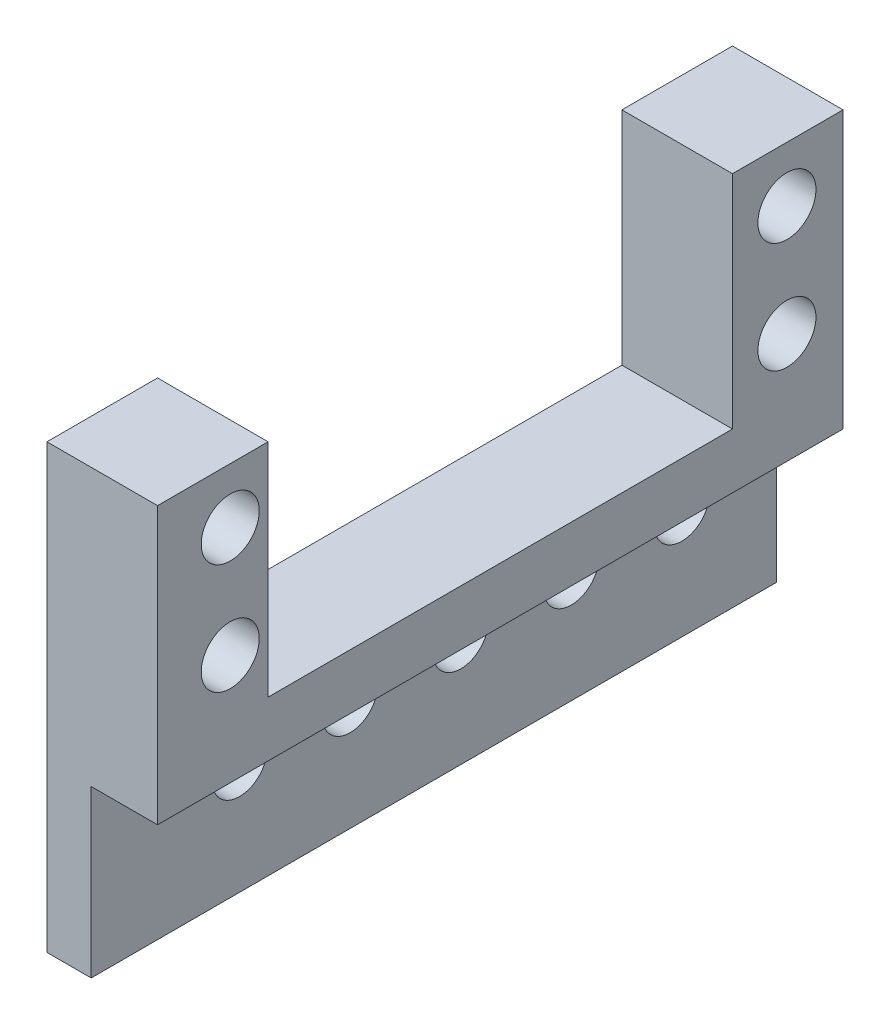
SolidWorks part; units mm, degrees
ref_plane "Front Plane" through (0, 0, 0) normal (0, 0, 1) x (1, 0, 0)
ref_plane "Top Plane" through (0, 0, 0) normal (0, 1, 0) x (1, 0, 0)
ref_plane "Right Plane" through (0, 0, 0) normal (1, 0, 0) x (0, 0, -1)
sketch "Sketch2" plane through (0, 0, 0) normal (0, 1, 0) x (1, 0, 0)
  line L1 (0, 0) -> (10, 0)
  line L2 (0, 0) -> (0, -62)
  line L3 (0, -62) -> (10, -62)
  line L4 (10, 0) -> (10, -62)
  line L5 (0, 0) -> (10, -62) construction
  line L6 (0, -62) -> (10, 0) construction
  point P4 (5, -31)
  dimension "D1" = 10
  dimension "D2" = 62
extrude "Boss-Extrude1" add sketch "Sketch2" along normal blind 5
sketch "Sketch3" plane through (0, 5, 0) normal (0, 1, 0) x (1, 0, 0)
  line L0 (10, -62) -> (10, 0) construction
  line L1 (0, 0) -> (10, 0)
  line L2 (0, 0) -> (0, -10)
  line L3 (0, -10) -> (10, -10)
  line L4 (10, 0) -> (10, -10)
  line L5 (0, 0) -> (10, -10) construction
  line L6 (0, -10) -> (10, 0) construction
  line L8 (0, -62) -> (10, -62)
  line L9 (0, -62) -> (0, -52)
  line L10 (0, -52) -> (10, -52)
  line L11 (10, -62) -> (10, -52)
  line L12 (0, -62) -> (10, -52) construction
  line L13 (0, -52) -> (10, -62) construction
  point P4 (5, -5)
  point P12 (5, -57)
  dimension "D1" = 10
  dimension "D2" = 10
extrude "Boss-Extrude2" add sketch "Sketch3" along normal blind 20
sketch "Sketch4" plane through (10, 0, 0) normal (1, 0, 0) x (0, 0, -1)
  line L0 (-5.075, 10) -> (-7.7, 10) construction
  line L1 (-5.075, 10) -> (-5.075, 20) construction
  line L2 (-5.075, 20) -> (-55.425, 20) construction
  line L3 (-55.425, 20) -> (-52.8, 20) construction
  line L4 (-55.425, 20) -> (-55.425, 10) construction
  arc A0 (-3.25, 11.8868) -> (-3.25, 8.1132) centre (-5.075, 10) ccw construction
  circle A1 centre (-5.075, 10) radius 2.625
  circle A2 centre (-5.075, 20) radius 2.625
  arc A3 (-57.25, 18.1132) -> (-57.25, 21.8868) centre (-55.425, 20) ccw construction
  circle A4 centre (-55.425, 20) radius 2.625
  circle A5 centre (-55.425, 10) radius 2.625
extrude "Cut-Extrude1" cut sketch "Sketch4" against normal blind 10
sketch "Sketch5" plane through (0, 0, 0) normal (-1, 0, 0) x (0, 0, 1)
  line L0 (0, 0) -> (0, -15)
  line L1 (0, -15) -> (62, -15)
  line L2 (62, 0) -> (62, -15)
  line L3 (0, 0) -> (62, 0)
  dimension "D1" = 15
extrude "Boss-Extrude3" add sketch "Sketch5" against normal blind 4
sketch "Sketch6" plane through (4, 0, 0) normal (1, 0, 0) x (0, 0, -1)
  line L0 (-2.9531, -5) -> (-59.1309, -5) construction
  line L1 (-62, 0) -> (0, 0) construction
  circle A0 centre (-8.5793, -5) radius 2.5
  circle A1 centre (-18.5793, -5) radius 2.5
  circle A2 centre (-28.5793, -5) radius 2.5
  circle A3 centre (-38.5793, -5) radius 2.5
  circle A4 centre (-48.5793, -5) radius 2.5
  dimension "D2" = 5
  dimension "D1" = 5
  dimension "D3" = 5
extrude "Cut-Extrude2" cut sketch "Sketch6" against normal blind 4
